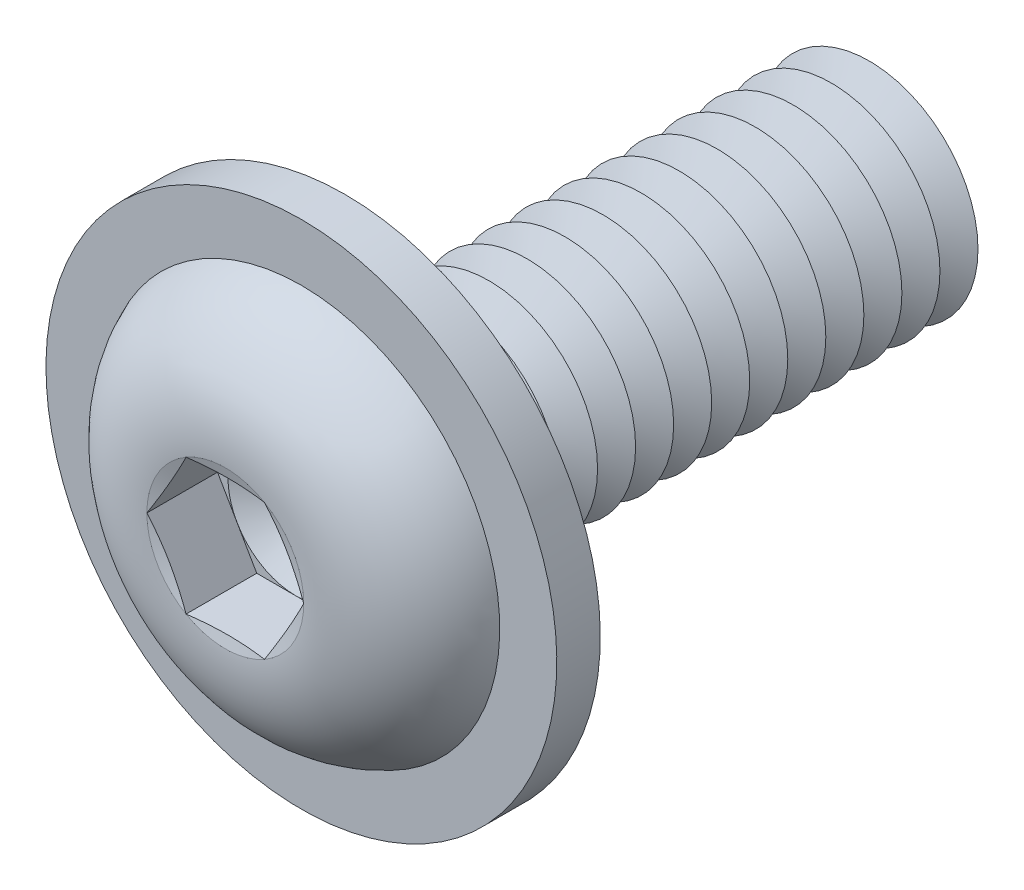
SolidWorks part; units mm, degrees
ref_plane "Front Plane" through (0, 0, 0) normal (0, 0, 1) x (1, 0, 0)
ref_plane "Top Plane" through (0, 0, 0) normal (0, 1, 0) x (1, 0, 0)
ref_plane "Right Plane" through (0, 0, 0) normal (1, 0, 0) x (0, 0, -1)
sketch "Sketch1" plane through (0, 0, 0) normal (1, 0, 0) x (0, 0, -1)
  line L0 (0, 2) -> (0, 3.8)
  line L3 (0, 2) -> (10, 2)
  line L4 (10, 2) -> (10, 0)
  line L5 (10, 0) -> (-2.2, 0) construction
  line L6 (-2.2, 0) -> (10, 0)
  line L7 (-2.2, 1.4434) -> (-2.2, 0.7217) construction
  line L8 (-2.2, 0.7217) -> (-2.2, 0)
  line L9 (-2.2, 1.4434) -> (-2.0066, 0.7217)
  line L10 (-2.0066, 0.7217) -> (-2.2, 0.7217)
  line L11 (10, 0) -> (22.7481, 0) construction
  line L12 (0, 3.8) -> (-2.2, 3.8) construction
  arc A1 (0, 3.8) -> (-2.2, 1.4434) centre (0, 1.5948) ccw
  point P8 (10, 1)
  dimension "D1" = 7.6
  dimension "D2" = 4
  dimension "D3" = 2.2
  dimension "D4" = 2.8868
  dimension "D5" = 10
  dimension "D6" = 15
revolve "Revolve1" add sketch "Sketch1" angle 360 about L5
fillet "Fillet1" radius 0.35 1 edges at (-2, 0, 0)
sketch "Sketch2" plane through (0, 0, 0) normal (1, 0, 0) x (0, 0, -1)
  line L0 (9.65, 2) -> (10.35, 2)
  line L1 (10, 2) -> (0.35, 2) construction
  line L2 (10.35, 2) -> (10, 1.3938)
  line L3 (10, -2) -> (10, 2) construction
  line L4 (10, 1.3938) -> (9.65, 2)
  dimension "D1" = 0.7
revolve "Cut-Revolve1" cut sketch "Sketch2" angle 360 about axis through (0, 0, -10) along (0, 0, -1)
pattern_linear "LPattern1" count 14 spacing 0.7 along (0, 0, 1) of "Cut-Revolve1"
sketch "Sketch3" plane through (0, 0, 2.2) normal (0, 0, 1) x (1, 0, 0)
  line L7 (0.7217, 1.25) -> (-0.7217, 1.25)
  line L8 (-0.7217, 1.25) -> (-1.4434, 0)
  line L9 (-1.4434, 0) -> (-0.7217, -1.25)
  line L10 (-0.7217, -1.25) -> (0.7217, -1.25)
  line L11 (0.7217, -1.25) -> (1.4434, 0)
  line L12 (1.4434, 0) -> (0.7217, 1.25)
  circle A0 centre (0, 0) radius 1.25 construction
  circle A3 centre (0, 0) radius 1.4434 construction
extrude "Cut-Extrude1" cut sketch "Sketch3" against normal blind 1.3
sketch "Sketch4" plane through (0, 0, 0.9) normal (0, 0, 1) x (1, 0, 0)
  line L1 (0.7217, 1.25) -> (-0.7217, 1.25) construction
  circle A0 centre (0, 0) radius 1.25
extrude "Cut-Extrude2" cut sketch "Sketch4" against normal through all draft 60
sketch "Sketch5" plane through (0, 0, 0) normal (0, 0, -1) x (-1, 0, 0)
  circle A0 centre (0, 0) radius 4.7
  circle A1 centre (0, 0) radius 2.35
  circle A2 centre (0, 0) radius 2.35 construction
  dimension "D1" = 9.4
extrude "Boss-Extrude1" add sketch "Sketch5" against normal blind 0.8
